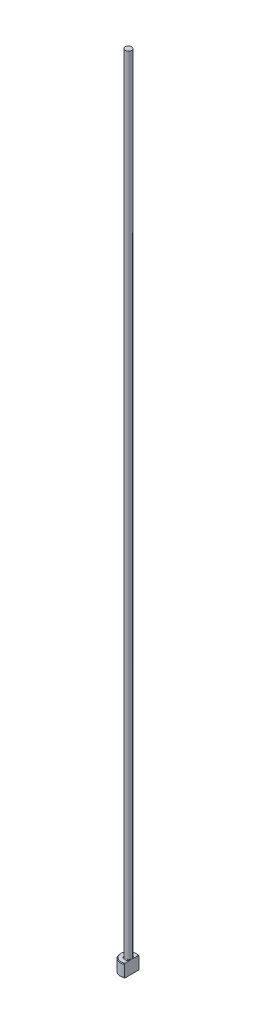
SolidWorks part; units mm, degrees
ref_plane "Front Plane" through (0, 0, 0) normal (0, 0, 1) x (1, 0, 0)
ref_plane "Top Plane" through (0, 0, 0) normal (0, 1, 0) x (1, 0, 0)
ref_plane "Right Plane" through (0, 0, 0) normal (1, 0, 0) x (0, 0, -1)
sketch "Sketch1" plane through (0, 0, 0) normal (0, 0, 1) x (1, 0, 0)
  line L0 (0, 259.9588) -> (0, -15.1925) construction
  line L1 (0, 0) -> (-2.5, 0)
  line L2 (-2.5, 0) -> (-2.5, 4)
  line L3 (-2.5, 4) -> (-1, 4)
  line L4 (-1, 4) -> (-1, 250)
  line L5 (-1, 250) -> (0, 250)
  line L6 (0, 250) -> (0, 0)
  dimension "L" = 250
  dimension "H" = 5
  dimension "T" = 4
  dimension "D" = 2
revolve "Revolve1" add sketch "Sketch1" angle 360 about L0
chamfer "Chamfer1" distance 0.2 angle 45 2 edges at (0, 4, 2.5) (0, 0, 2.5)
fillet "Fillet1" radius 0.2 1 edges at (0, 4, 1)
sketch "Sketch2" plane through (0, 0, 0) normal (0, 1, 0) x (1, 0, 0)
  line L0 (1, -2.2913) -> (1, 2.2913)
  circle A0 centre (0, 0) radius 2.5 construction
  arc A1 (1, -2.2913) -> (1, 2.2913) centre (0, 0) ccw
  circle A2 centre (0, 0) radius 1 construction
extrude "KEYED HEAD" cut sketch "Sketch2" along normal through all
